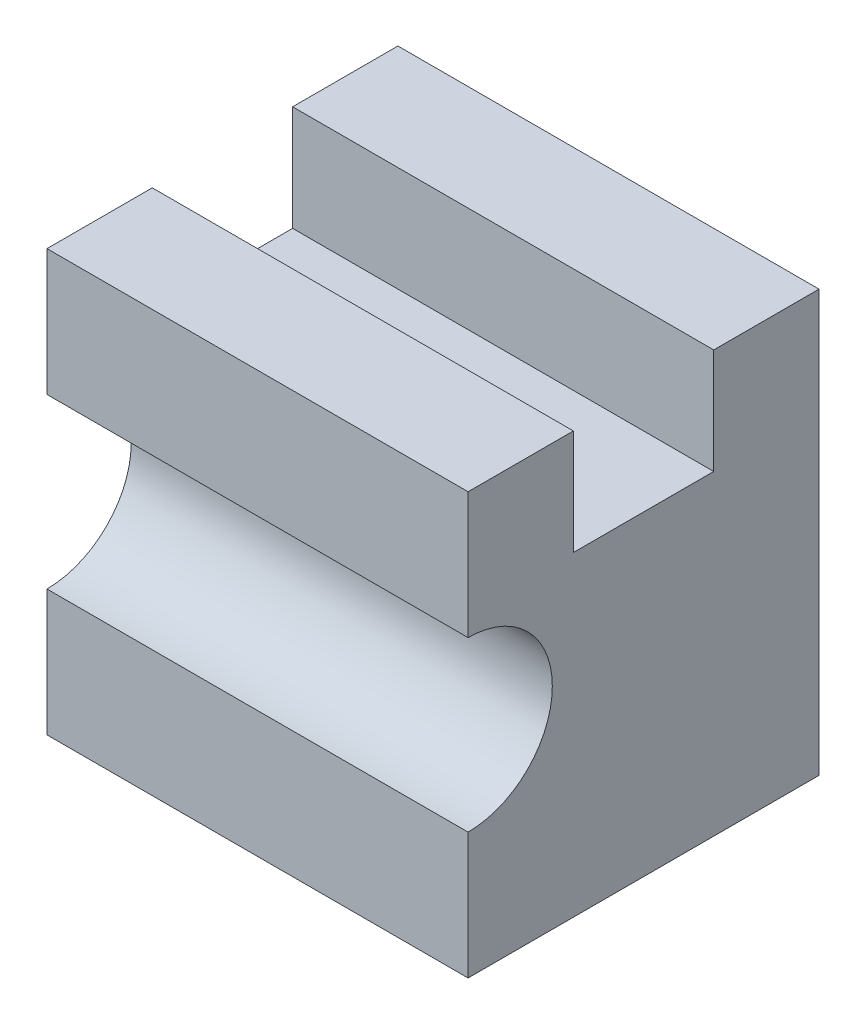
SolidWorks part; units mm, degrees
ref_plane "Front Plane" through (0, 0, 0) normal (0, 0, 1) x (1, 0, 0)
ref_plane "Top Plane" through (0, 0, 0) normal (0, 1, 0) x (1, 0, 0)
ref_plane "Right Plane" through (0, 0, 0) normal (1, 0, 0) x (0, 0, -1)
sketch "Sketch1" plane through (0, 0, 0) normal (1, 0, 0) x (0, 0, -1)
  line L0 (0, 0) -> (0, 18)
  line L1 (0, 60) -> (15, 60)
  line L2 (15, 60) -> (15, 45)
  line L3 (15, 45) -> (35, 45)
  line L4 (35, 45) -> (35, 60)
  line L5 (35, 60) -> (50, 60)
  line L6 (50, 60) -> (50, 0)
  line L7 (50, 0) -> (0, 0)
  line L8 (0, 42) -> (0, 60)
  arc A0 (0, 18) -> (0, 42) centre (0, 30) ccw
  dimension "D5" = 12
  dimension "D1" = 50
  dimension "D2" = 60
  dimension "D3" = 15
  dimension "D4" = 15
extrude "Extrude1" add sketch "Sketch1" along normal mid plane 60
